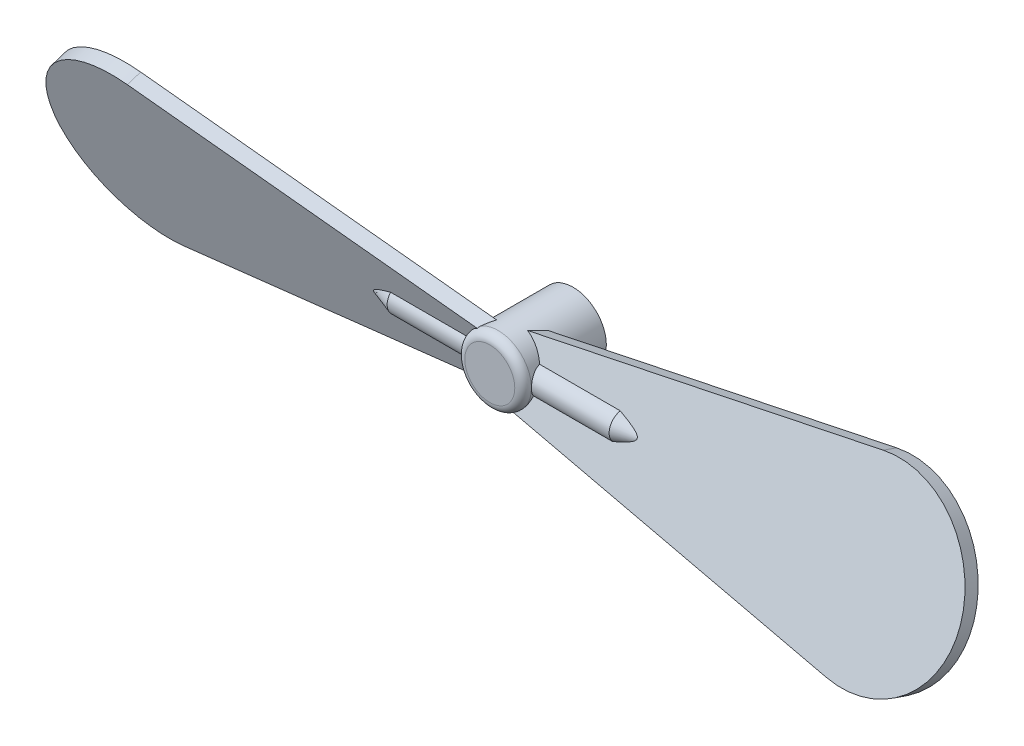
SolidWorks part; units mm, degrees
ref_plane "Face" through (0, 0, 0) normal (0, 0, 1) x (1, 0, 0)
ref_plane "Dessus" through (0, 0, 0) normal (0, 1, 0) x (1, 0, 0)
ref_plane "Droite" through (0, 0, 0) normal (1, 0, 0) x (0, 0, -1)
sketch "Esquisse1" plane through (0, 0, 0) normal (0, 0, 1) x (1, 0, 0)
  circle A0 centre (0, 0) radius 1.2
  dimension "D1" = 2.4
extrude "Extrusion1" add sketch "Esquisse1" along normal blind 0.8 and the other way blind 2.2
fillet "Congé2" radius 0.3 1 edges at (1.2, 0, 0.8)
sketch "Esquisse2" plane through (0, 0, 0) normal (0, 0, 1) x (1, 0, 0)
  line L0 (0, 0) -> (5.5, 0) construction
  line L1 (0, 0.5) -> (4, 0.5)
  line L2 (4, 0.5) -> (5.5, 0)
  line L3 (5.5, 0) -> (0, 0)
  line L4 (0, 0) -> (0, 0.5)
  dimension "D1" = 0.5
  dimension "D2" = 5.5
  dimension "D3" = 1.5
revolve "Révolution1" add sketch "Esquisse2" angle 360 about L0
ref_plane "Plan1" through (0, 0, 0) normal (0, 0.3206, 0.9472) x (1, 0, 0)
sketch "Esquisse3" plane through (0, 0, 0) normal (0, 0.3206, 0.9472) x (1, 0, 0)
  line L0 (0, 0) -> (13.15, 0) construction
  line L1 (-0.1711, -0.9853) -> (12.5939, -3.2021)
  line L2 (-0.1711, 0.9853) -> (12.5939, 3.2021)
  arc A0 (12.5939, -3.2021) -> (12.5939, 3.2021) centre (13.15, 0) ccw
  arc A1 (-0.1711, 0.9853) -> (-0.1711, -0.9853) centre (0, 0) ccw
  dimension "D1" = 6.5
  dimension "D2" = 2
  dimension "D3" = 13.15
extrude "Extrusion2" add sketch "Esquisse3" along normal mid plane 0.5
pattern_circular "Répétition circulaire1" count 2 over 360 about axis through (0, 0, 0) along (0, 0, 1) of "Extrusion2", "Révolution1"
sketch "Esquisse4" plane through (0, 0, -2.2) normal (0, 0, -1) x (-1, 0, 0)
  circle A0 centre (0, 0) radius 0.4
  dimension "D1" = 0.8
extrude "Extrusion3" cut sketch "Esquisse4" against normal blind 2.2
